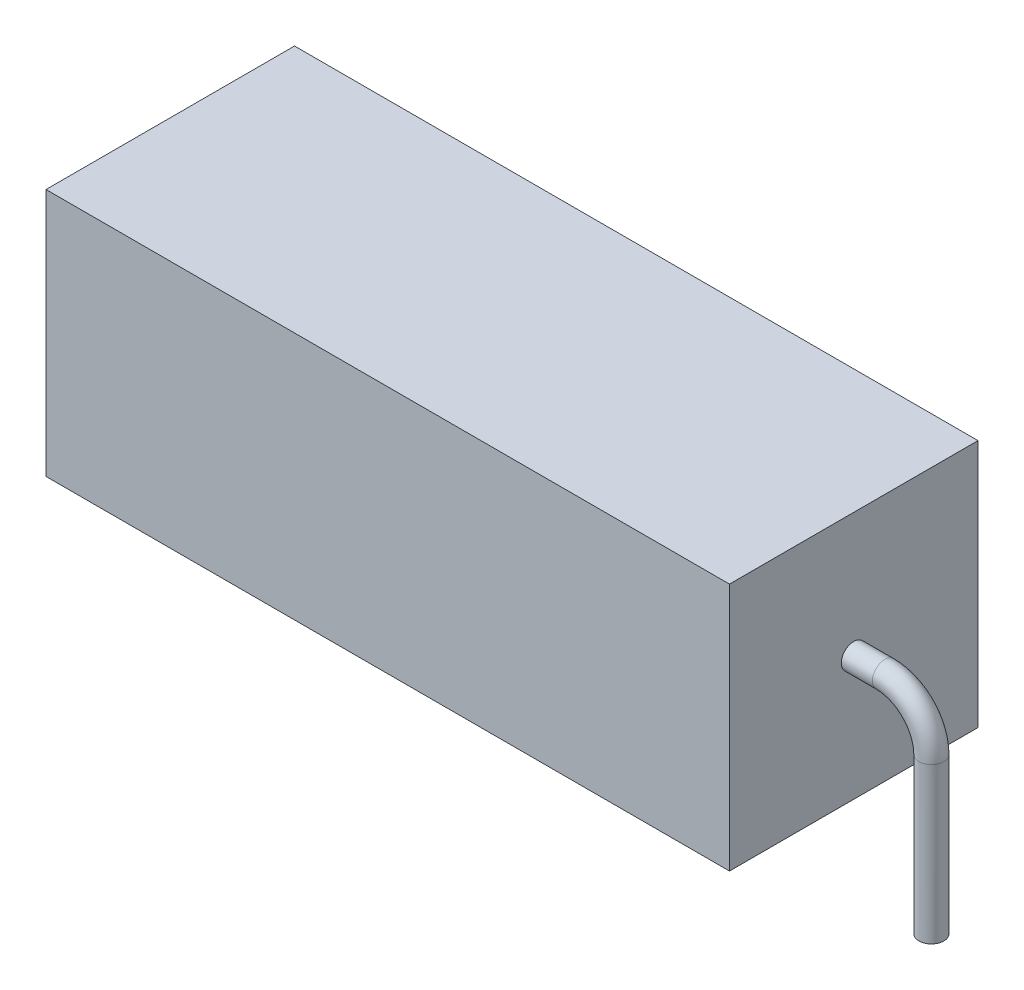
SolidWorks part; units mm, degrees
ref_plane "Front" through (0, 0, 0) normal (0, 0, 1) x (1, 0, 0)
ref_plane "Top" through (0, 0, 0) normal (0, 1, 0) x (1, 0, 0)
ref_plane "Right" through (0, 0, 0) normal (1, 0, 0) x (0, 0, -1)
sketch "Эскиз2" plane through (0, 0, 0) normal (1, 0, 0) x (0, 0, -1)
  line L1 (0, 0) -> (8, 0)
  line L2 (0, 0) -> (0, 8)
  line L3 (0, 8) -> (8, 8)
  line L4 (8, 0) -> (8, 8)
  dimension "W" = 8
extrude "Вытянуть1" add sketch "Эскиз2" along normal blind 22
ref_plane "Плоскость1" through (0, 0, -4) normal (0, 0, 1) x (1, 0, 0)
sketch "Эскиз3" plane through (0, 0, -4) normal (0, 0, 1) x (1, 0, 0)
  line L0 (22, 4) -> (23, 4)
  line L1 (24.5, 2.5) -> (24.5, -2.5)
  line L2 (22, 8) -> (22, 0) construction
  line L3 (22, 0) -> (0, 0) construction
  arc A0 (23, 4) -> (24.5, 2.5) centre (23, 2.5) cw
  dimension "D1" = 1.5
  dimension "D2" = 2.5
  dimension "D3" = 2.5
sketch "Эскиз4" plane through (22, 0, 0) normal (1, 0, 0) x (0, 0, -1)
  circle A0 centre (4, 4) radius 0.4
  dimension "D1" = 0.8
sweep "По траектории1" add profiles "Эскиз4" path "Эскиз3"
ref_plane "Плоскость2" through (11, 0, 0) normal (1, 0, 0) x (0, 0, -1)
mirror "Зеркальное отражение1" about plane through (11, 0, 0) normal (1, 0, 0) of "По траектории1"
